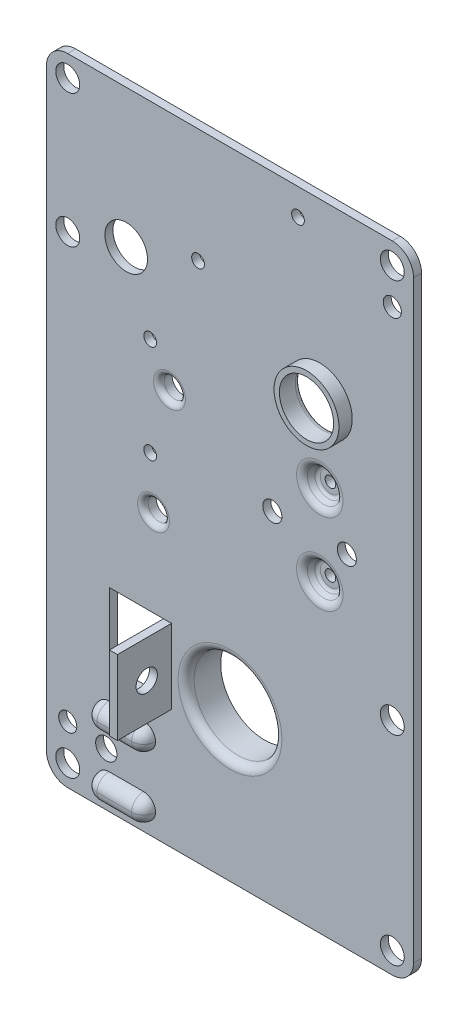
SolidWorks part; units mm, degrees
ref_plane "Plan1" through (0, 0, 0) normal (0, 0, 1) x (1, 0, 0)
ref_plane "Plan2" through (0, 0, 0) normal (0, 1, 0) x (1, 0, 0)
ref_plane "Plan3" through (0, 0, 0) normal (1, 0, 0) x (0, 0, -1)
sketch "Esquisse2" plane through (0, 0, 29.3) normal (0, 0, 1) x (1, 0, 0)
  line L4 (34.5012, 55.7512) -> (34.5012, -55.7512)
  line L5 (30.5012, -59.7512) -> (-30.5012, -59.7512)
  line L6 (-34.5012, -55.7512) -> (-34.5012, 55.7512)
  line L7 (30.5012, 59.7512) -> (-30.5012, 59.7512)
  arc A0 (-30.5012, 59.7512) -> (-34.5012, 55.7512) centre (-30.5012, 55.7512) ccw
  arc A1 (34.5012, 55.7512) -> (30.5012, 59.7512) centre (30.5012, 55.7512) ccw
  arc A2 (30.5012, -59.7512) -> (34.5012, -55.7512) centre (30.5012, -55.7512) ccw
  arc A3 (-34.5012, -55.7512) -> (-30.5012, -59.7512) centre (-30.5012, -55.7512) ccw
  dimension "D1" = 8
extrude "Base-Extrusion" add sketch "Esquisse2" along normal blind 1.5
sketch "Esquisse6" plane through (0, 0, 29.3) normal (0, 0, -1) x (-1, 0, 0)
  circle A2 centre (11.3689, 14.538) radius 3
  circle A3 centre (11.3689, 14.538) radius 3
  dimension "D1" = 1
extrude "Boss.-Extru.1" add sketch "Esquisse6" along normal blind 1 draft 45
sketch "Esquisse8" plane through (0, 0, 28.3) normal (0, 0, -1) x (-1, 0, 0)
  circle A0 centre (11.3689, 14.538) radius 2 construction
  circle A1 centre (11.3689, 14.538) radius 2
extrude "Enlèv. mat.-Extru.8" cut sketch "Esquisse8" against normal blind 10
sketch "Esquisse9" plane through (0, 0, 29.3) normal (0, 0, -1) x (-1, 0, 0)
  circle A2 centre (14.375, -6.8518) radius 3
  circle A3 centre (14.375, -6.8518) radius 3
  dimension "D1" = 1
extrude "Boss.-Extru.2" add sketch "Esquisse9" along normal blind 1 draft 45
sketch "Esquisse11" plane through (0, 0, 28.3) normal (0, 0, -1) x (-1, 0, 0)
  circle A1 centre (14.375, -6.8518) radius 2 construction
  circle A2 centre (14.375, -6.8518) radius 2
extrude "Enlèv. mat.-Extru.13" cut sketch "Esquisse11" against normal through all
fillet "Congé5" radius 1
sketch "Esquisse12" plane through (0, 0, 29.3) normal (0, 0, -1) x (-1, 0, 0)
  circle A2 centre (-16.875, 12.7284) radius 4
  circle A3 centre (-16.875, 12.7284) radius 4
  dimension "D1" = 3
extrude "Boss.-Extru.3" add sketch "Esquisse12" along normal blind 2 draft 30
sketch "Esquisse30" plane through (0, 0, 30.8) normal (0, 0, 1) x (1, 0, 0)
  circle A0 centre (16.875, 12.7284) radius 1 construction
  circle A1 centre (16.875, 12.7284) radius 1
extrude "Enlèv. mat.-Extru.29" cut sketch "Esquisse30" against normal blind 10
sketch "Esquisse31" plane through (0, 0, 27.3) normal (0, 0, -1) x (-1, 0, 0)
  circle A0 centre (-16.875, 12.7284) radius 1 construction
  circle A1 centre (-16.875, 12.7284) radius 1
  circle A2 centre (-16.875, 12.7284) radius 1.6
  dimension "D1" = 0.6
extrude "Boss.-Extru.10" add sketch "Esquisse31" along normal blind 0.5
sketch "Esquisse32" plane through (0, 0, 30.8) normal (0, 0, 1) x (1, 0, 0)
  circle A0 centre (16.875, 12.7284) radius 3.5
  dimension "D1" = 7
extrude "Enlèv. mat.-Extru.30" cut sketch "Esquisse32" against normal blind 2 draft 30
sketch "Esquisse13" plane through (0, 0, 29.3) normal (0, 0, -1) x (-1, 0, 0)
  circle A2 centre (-16.875, -2.5216) radius 4
  circle A3 centre (-16.875, -2.5216) radius 4
  dimension "D1" = 3
extrude "Boss.-Extru.4" add sketch "Esquisse13" along normal blind 2 draft 30
sketch "Esquisse14" plane through (0, 0, 27.3) normal (0, 0, -1) x (-1, 0, 0)
  circle A3 centre (-16.875, -2.5216) radius 1 construction
  circle A5 centre (-16.875, -2.5216) radius 1
  circle A7 centre (-16.875, -2.5216) radius 1.6
  dimension "D2" = 0.6
extrude "Boss.-Extru.5" add sketch "Esquisse14" along normal blind 0.5
sketch "Esquisse15" plane through (0, 0, 30.8) normal (0, 0, 1) x (1, 0, 0)
  circle A1 centre (16.875, -2.5216) radius 3.5
  dimension "D1" = 7
extrude "Enlèv. mat.-Extru.18" cut sketch "Esquisse15" against normal blind 2 draft 30
sketch "Esquisse17" plane through (0, 0, 27.3) normal (0, 0, -1) x (-1, 0, 0)
  circle A0 centre (-16.875, -2.5216) radius 1 construction
  circle A2 centre (-16.875, -2.5216) radius 1
extrude "Enlèv. mat.-Extru.19" cut sketch "Esquisse17" against normal through all
fillet "Congé1" radius 0.25
fillet "Congé2" radius 1
fillet "Congé3" radius 1.5
fillet "Congé4" radius 0.75
sketch "Esquisse18" plane through (0, 0, 30.8) normal (0, 0, 1) x (1, 0, 0)
  line L0 (0, -31.75) -> (16.875, -2.5216) construction
  circle A0 centre (30.5012, 55.7512) radius 2.25
  circle A1 centre (30.5, 49) radius 1.7
  circle A2 centre (-30.5012, 55.7512) radius 2.25
  circle A3 centre (-30.5012, 30.7488) radius 2.25
  circle A4 centre (-30.5, -49) radius 1.7
  circle A5 centre (-30.5012, -55.7512) radius 2.25
  circle A6 centre (30.5012, -18.2512) radius 2.25
  circle A7 centre (30.5012, -55.7512) radius 2.25
  circle A8 centre (0, -31.75) radius 8.25
  dimension "D1" = 4.5
  dimension "D2" = 3.4
  dimension "D3" = 16.5
extrude "Enlèv. mat.-Extru.20" cut sketch "Esquisse18" against normal through all
sketch "Esquisse19" plane through (0, 0, 30.8) normal (0, 0, 1) x (1, 0, 0)
  line L0 (-34.5012, 55.7512) -> (-34.5012, -55.7512) construction
  line L1 (-30.5012, -59.7512) -> (30.5012, -59.7512) construction
  line L2 (-15.0042, 21.0042) -> (-15.0042, 2.5042) construction
  line L3 (7.9542, 4.4784) -> (21.9542, 4.4784) construction
  line L7 (0, 75) -> (0, -74) construction
  line L8 (51, 0) -> (-54, 0) construction
  circle A0 centre (-19.5042, 33.7542) radius 4
  circle A1 centre (-15.0042, 21.0042) radius 1.2
  circle A2 centre (-15.0042, 2.5042) radius 1.2
  circle A3 centre (21.9542, 4.4784) radius 1.8
  circle A4 centre (7.9542, 4.4784) radius 1.8
  circle A6 centre (-23.2542, -49.7542) radius 2
  circle A7 centre (16.875, -2.5216) radius 1 construction
  dimension "D3" = 8
  dimension "D5" = 2.4
  dimension "D9" = 3.6
  dimension "D12" = 11.247
  dimension "D14" = 4
  dimension "D7" = 7
  dimension "D1" = 19.5042
  dimension "D2" = 33.7542
  dimension "D4" = 7.9542
  dimension "D6" = 14
  dimension "D8" = 21.0042
  dimension "D10" = 15.0042
  dimension "D11" = 18.5
  dimension "D13" = 9.997
extrude "Enlèv. mat.-Extru.21" cut sketch "Esquisse19" against normal through all
sketch "Esquisse20" plane through (0, 0, 30.8) normal (0, 0, 1) x (1, 0, 0)
  line L0 (-29, -44.0042) -> (-12, -44.0042) construction
  line L1 (-29, -55.5042) -> (-12, -55.5042) construction
  line L3 (-25.0042, -40) -> (-25.0042, -61) construction
  line L5 (-14, -41) -> (-14, -62) construction
  line L6 (-14, -41.7542) -> (-25.0042, -41.7542)
  line L7 (-14, -46.2542) -> (-25.0042, -46.2542)
  line L8 (-14, -41.7542) -> (-14, -46.2542)
  line L9 (-25.0042, -41.7542) -> (-25.0042, -46.2542)
  line L10 (-25.0042, -53.2542) -> (-14, -53.2542)
  line L11 (-25.0042, -57.7542) -> (-14, -57.7542)
  line L12 (-14, -53.2542) -> (-14, -57.7542)
  line L13 (-25.0042, -53.2542) -> (-25.0042, -57.7542)
  line L14 (-34.5012, 55.7512) -> (-34.5012, -55.7512) construction
  line L15 (-30.5012, -59.7512) -> (30.5012, -59.7512) construction
  dimension "D1" = 15.747
  dimension "D2" = 4.247
  dimension "D3" = 9.497
  dimension "D4" = 20.5012
  dimension "D5" = 4.5
extrude "Boss.-Extru.6" add sketch "Esquisse20" along normal blind 2.25
fillet "Congé6" radius 2.25
fillet "Congé7" radius 2.25
sketch "Esquisse21" plane through (0, 0, 29.3) normal (0, 0, -1) x (-1, 0, 0)
  line L1 (19.5021, -41.7542) -> (19.5021, -54.4851) construction
  line L7 (16.25, -41.7542) -> (22.7542, -41.7542) construction
  line L10 (15.5021, -42.7542) -> (23.5021, -42.7542)
  line L11 (23.5021, -42.7542) -> (23.5021, -45.2542)
  line L12 (22.7542, -44.0042) -> (25.0042, -44.0042) construction
  line L13 (15.5021, -42.7542) -> (15.5021, -45.2542)
  line L18 (26.4503, -44.0042) -> (11.312, -44.0042) construction
  line L19 (15.5021, -45.2542) -> (23.5021, -45.2542)
  line L20 (10.9533, -55.5042) -> (26.4503, -55.5042) construction
  line L21 (15.5021, -54.2542) -> (23.5021, -54.2542)
  line L22 (23.5021, -54.2542) -> (23.5021, -56.7542)
  line L23 (15.5021, -56.7542) -> (23.5021, -56.7542)
  line L24 (15.5021, -54.2542) -> (15.5021, -56.7542)
  point P10 (19.5021, -42.7542)
  point P14 (15.5021, -44.0042)
  point P15 (23.5021, -44.0042)
  point P24 (23.5021, -55.5042)
  point P25 (19.5021, -56.7542)
  point P26 (19.5021, -54.2542)
  dimension "D1" = 2.5
  dimension "D2" = 8
extrude "Enlèv. mat.-Extru.22" cut sketch "Esquisse21" against normal blind 2.25
fillet "Congé8" radius 1.25
fillet "Congé9" radius 1.25
fillet "Congé10" radius 0.75
sketch "Esquisse22" plane through (0, 0, 29.3) normal (0, 0, -1) x (-1, 0, 0)
  circle A0 centre (0, -31.75) radius 8.25 construction
  circle A1 centre (0, -31.75) radius 8.25
  circle A2 centre (0, -31.75) radius 9.75
  dimension "D1" = 1.5
extrude "Boss.-Extru.7" add sketch "Esquisse22" along normal blind 5
fillet "Congé11" radius 1.5
chamfer "Chanfrein1" distance 0.5 angle 45
sketch "Esquisse23" plane through (0, 0, 30.8) normal (0, 0, 1) x (1, 0, 0)
  line L0 (0, 75) -> (0, -74) construction
  line L1 (-12.5042, -23.2542) -> (-11.0042, -23.2542)
  line L2 (-12.5042, -23.2542) -> (-12.5042, -37.2542)
  line L3 (-12.5042, -37.2542) -> (-11.0042, -37.2542)
  line L4 (-11.0042, -23.2542) -> (-11.0042, -37.2542)
  line L5 (51, 0) -> (-54, 0) construction
  dimension "D1" = 14
  dimension "D2" = 23.2542
  dimension "D3" = 1.5
  dimension "D4" = 12.5042
extrude "Boss.-Extru.8" add sketch "Esquisse23" along normal blind 10.15
sketch "Esquisse24" plane through (0, 0, 30.8) normal (0, 0, 1) x (1, 0, 0)
  line L0 (-11.0042, -37.2542) -> (-11.0042, -23.2542) construction
  line L1 (-12.5042, -23.2542) -> (-22.6542, -23.2542)
  line L2 (-12.5042, -23.2542) -> (-12.5042, -37.2542)
  line L3 (-12.5042, -37.2542) -> (-22.6542, -37.2542)
  line L4 (-22.6542, -23.2542) -> (-22.6542, -37.2542)
  dimension "D1" = 10.15
extrude "Enlèv. mat.-Extru.23" cut sketch "Esquisse24" against normal through all
fillet "Congé12" radius 1
sketch "Esquisse25" plane through (-11.0042, 0, 0) normal (1, 0, 0) x (0, 0, -1)
  line L1 (-40.95, -23.2542) -> (-30.8, -23.2542) construction
  line L2 (-40.95, -37.2542) -> (-30.8, -37.2542) construction
  line L3 (-40.95, -37.2542) -> (-40.95, -23.2542) construction
  circle A0 centre (-35.45, -30.2542) radius 2
  point P2 (-35.875, -23.2542)
  dimension "D2" = 4
  dimension "D1" = 14
  dimension "D3" = 5.5
  dimension "D4" = 7
extrude "Enlèv. mat.-Extru.24" cut sketch "Esquisse25" against normal through all
sketch "Esquisse26" plane through (0, 0, 30.8) normal (0, 0, 1) x (1, 0, 0)
  circle A0 centre (16.875, 26.9784) radius 5.1
  dimension "D2" = 10.2
extrude "Enlèv. mat.-Extru.25" cut sketch "Esquisse26" against normal through all
sketch "Esquisse27" plane through (0, 0, 29.3) normal (0, 0, -1) x (-1, 0, 0)
  circle A0 centre (-16.875, 26.9784) radius 5.1 construction
  circle A1 centre (-16.875, 26.9784) radius 5.1
  circle A2 centre (-16.875, 26.9784) radius 6.1
  dimension "D1" = 1
extrude "Boss.-Extru.9" add sketch "Esquisse27" against normal blind 4
fillet "Congé13" radius 1
sketch "Esquisse28" plane through (0, 0, 30.8) normal (0, 0, 1) x (1, 0, 0)
  line L0 (51, 0) -> (-54, 0) construction
  line L1 (0, 75) -> (0, -74) construction
  circle A0 centre (-6.0042, 38.2542) radius 1.2
  circle A1 centre (12.7775, 54.7542) radius 1.2
  dimension "D3" = 16.5
  dimension "D5" = 2.4
  dimension "D1" = 6.0042
  dimension "D2" = 38.2542
  dimension "D4" = 25
extrude "Enlèv. mat.-Extru.26" cut sketch "Esquisse28" against normal through all
sketch "Esquisse29" plane through (0, 0, 24.3) normal (0, 0, -1) x (-1, 0, 0)
  line L3 (-2.8961, -31.75) -> (-11.511, -31.75) construction
  line L4 (-8.0039, -29.75) -> (-9.5427, -29.75)
  line L5 (-8.0039, -33.75) -> (-9.5427, -33.75)
  circle A0 centre (0, -31.75) radius 8.25 construction
  circle A1 centre (0, -31.75) radius 9.75 construction
  arc A4 (-9.5427, -29.75) -> (-9.5427, -33.75) centre (0, -31.75) ccw
  arc A5 (-8.0039, -29.75) -> (-8.0039, -33.75) centre (0, -31.75) ccw
  dimension "D2" = 2
extrude "Enlèv. mat.-Extru.28" cut sketch "Esquisse29" against normal blind 4
sketch "Esquisse33" plane through (0, 0, 30.8) normal (0, 0, 1) x (1, 0, 0)
  line L0 (16.875, 26.9784) -> (-19.492, 26.9784) construction
